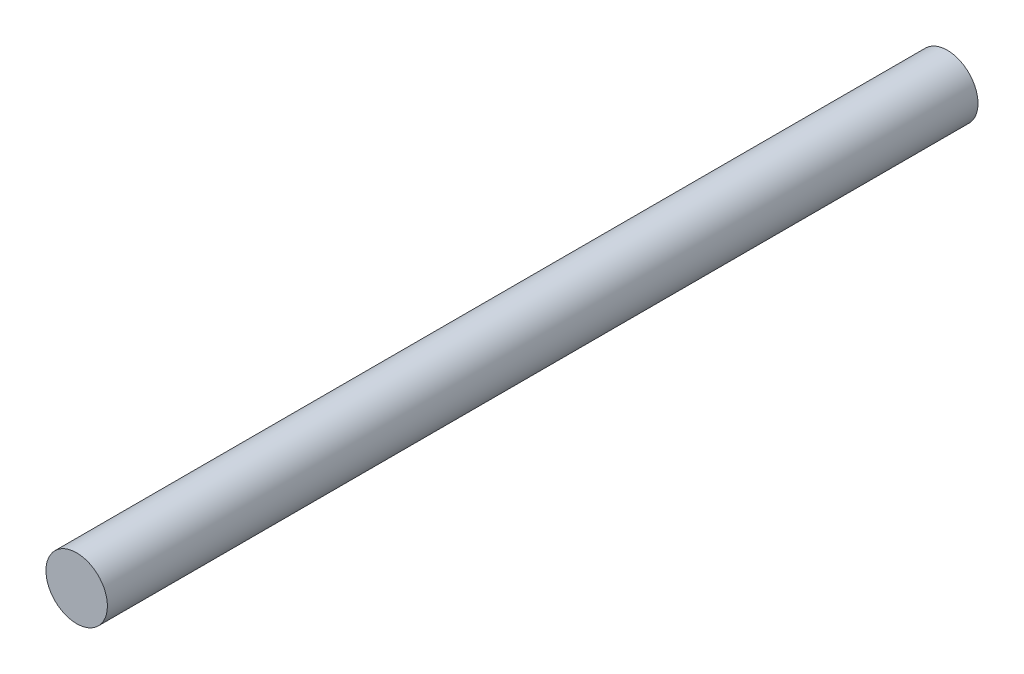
SolidWorks part; units mm, degrees
ref_plane "Front Plane" through (0, 0, 0) normal (0, 0, 1) x (1, 0, 0)
ref_plane "Top Plane" through (0, 0, 0) normal (0, 1, 0) x (1, 0, 0)
ref_plane "Right Plane" through (0, 0, 0) normal (1, 0, 0) x (0, 0, -1)
sketch "Sketch1" plane through (0, 0, 0) normal (0, 0, 1) x (1, 0, 0)
  circle A0 centre (0, 0) radius 30
  dimension "D1" = 60
extrude "Boss-Extrude1" add sketch "Sketch1" against normal blind 850
